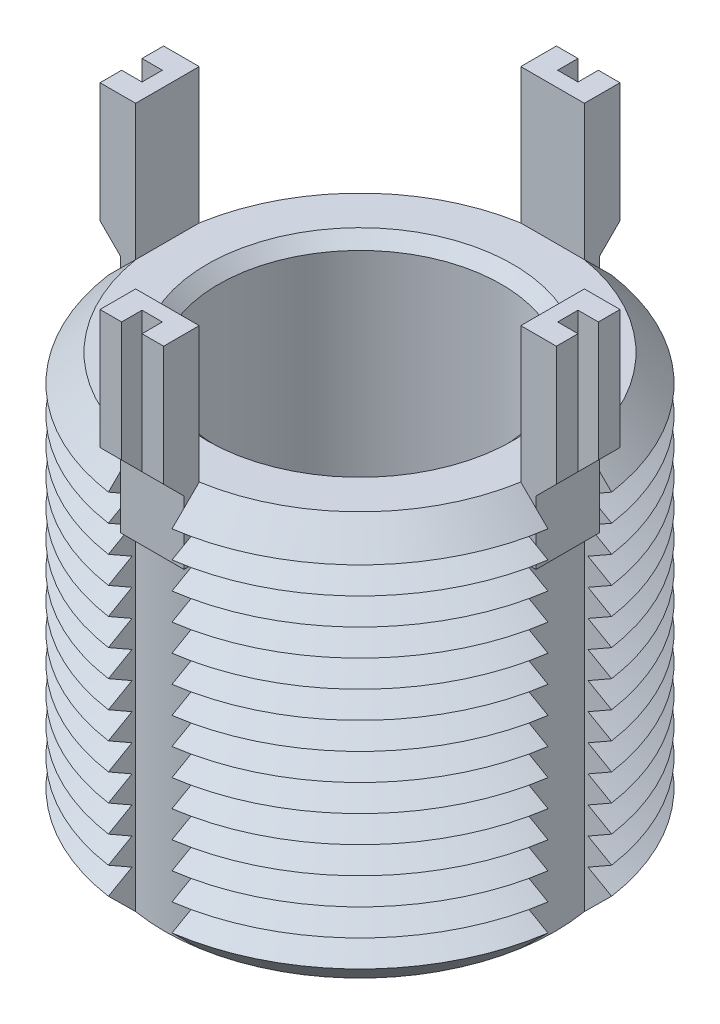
SolidWorks part; units mm, degrees
ref_plane "Front Plane" through (0, 0, 0) normal (0, 0, 1) x (1, 0, 0)
ref_plane "Top Plane" through (0, 0, 0) normal (0, 1, 0) x (1, 0, 0)
ref_plane "Right Plane" through (0, 0, 0) normal (1, 0, 0) x (0, 0, -1)
sketch "Sketch1" plane through (0, 0, 0) normal (0, 1, 0) x (1, 0, 0)
  circle A0 centre (0, 0) radius 17.4625
  dimension "D1" = 34.925
extrude "Boss-Extrude1" add sketch "Sketch1" against normal blind 31.75
chamfer "Chamfer1" distance 2.117 angle 45 2 edges at (0, -31.75, 17.4625) (0, 0, 17.4625)
sketch "Sketch2" plane through (0, 0, 0) normal (1, 0, 0) x (0, 0, -1)
  line L0 (0, 0.8859) -> (0, -9.2617) construction
sketch "Sketch3" plane through (0, 0, 0) normal (1, 0, 0) x (0, 0, -1)
  line L0 (-17.4625, -2.117) -> (-15.6291, -3.1755)
  line L1 (-15.6291, -3.1755) -> (-17.4625, -4.234)
  line L2 (-17.4625, -2.117) -> (-17.4625, -29.633) construction
  line L3 (-17.4625, -4.234) -> (-17.4625, -2.117)
  dimension "D1" = 2.117
revolve "Cut-Revolve1" cut sketch "Sketch3" angle 360 about L0
pattern_linear "LPattern1" count 13 spacing 2.117 along (0, -1, 0) of "Cut-Revolve1"
sketch "Sketch4" plane through (0, 0, 0) normal (0, 1, 0) x (1, 0, 0)
  line L0 (-15.1405, 2.5) -> (-17.2826, 2.5)
  line L2 (-17.2826, -2.5) -> (-15.1405, -2.5)
  arc A0 (-15.1405, 2.5) -> (-15.1405, -2.5) centre (0, 0) ccw
  arc A1 (-17.2826, 2.5) -> (-17.2826, -2.5) centre (0, 0) ccw
  circle A2 centre (0, 0) radius 17.4625 construction
  circle A3 centre (0, 0) radius 15.3455 construction
  point P1 (-15.3455, 0)
  point P3 (-17.4625, 0)
  point P13 (0, 0)
  dimension "D1" = 5
extrude "Cut-Extrude1" cut sketch "Sketch4" against normal up to surface (31.75 mm away)
pattern_circular "CirPattern1" count 4 over 360 about axis through (0, 0, 0) along (0, 1, 0) of "Cut-Extrude1"
sketch "Sketch5" plane through (0, 0, 0) normal (1, 0, 0) x (0, 0, -1)
  line L0 (-15.1405, 10.649) -> (-15.1405, -5.351)
  line L1 (-15.1405, -5.351) -> (-16.3405, -5.351)
  line L2 (-16.3405, -5.351) -> (-16.3405, -0.351)
  line L3 (-16.3405, -0.351) -> (-17.9405, 1.249)
  line L4 (-17.9405, 1.249) -> (-17.9405, 10.649)
  line L5 (-17.9405, 10.649) -> (-15.1405, 10.649)
  line L6 (-17.2826, -6.351) -> (-2.5, -6.351) construction
  point P9 (-2.5, 0)
  point P10 (-16.3405, -0.351)
  dimension "D1" = 1
  dimension "D2" = 16
  dimension "D3" = 11
  dimension "D4" = 2.8
  dimension "D5" = 1.2
  dimension "D6" = 45
extrude "Boss-Extrude3" add sketch "Sketch5" along normal mid plane 5
pattern_circular "CirPattern2" count 4 over 360 about axis through (0, 0, 0) along (0, 1, 0) of "Boss-Extrude3"
sketch "Sketch6" plane through (0, 10.649, 0) normal (0, 1, 0) x (1, 0, 0)
  line L0 (-17.9405, -2.5) -> (-17.9405, 2.5) construction
  line L1 (-17.9405, -0.8) -> (-16.3405, -0.8)
  line L2 (-17.9405, -0.8) -> (-17.9405, 0.8)
  line L3 (-17.9405, 0.8) -> (-16.3405, 0.8)
  line L4 (-16.3405, -0.8) -> (-16.3405, 0.8)
  line L5 (-17.9405, -0.8) -> (-16.3405, 0.8) construction
  line L6 (-17.9405, 0.8) -> (-16.3405, -0.8) construction
  line L7 (17.9405, 2.5) -> (17.9405, -2.5) construction
  line L8 (-0.8, 16.3405) -> (0.8, 16.3405)
  line L9 (-0.8, 16.3405) -> (-0.8, 17.9405)
  line L10 (-0.8, 17.9405) -> (0.8, 17.9405)
  line L11 (0.8, 16.3405) -> (0.8, 17.9405)
  line L12 (-0.8, 16.3405) -> (0.8, 17.9405) construction
  line L13 (-0.8, 17.9405) -> (0.8, 16.3405) construction
  line L14 (16.3405, -0.8) -> (17.9405, -0.8)
  line L15 (16.3405, -0.8) -> (16.3405, 0.8)
  line L16 (16.3405, 0.8) -> (17.9405, 0.8)
  line L17 (17.9405, -0.8) -> (17.9405, 0.8)
  line L18 (16.3405, -0.8) -> (17.9405, 0.8) construction
  line L19 (16.3405, 0.8) -> (17.9405, -0.8) construction
  line L20 (-0.8, -17.9405) -> (0.8, -17.9405)
  line L21 (-0.8, -17.9405) -> (-0.8, -16.3405)
  line L22 (-0.8, -16.3405) -> (0.8, -16.3405)
  line L23 (0.8, -17.9405) -> (0.8, -16.3405)
  line L24 (-0.8, -17.9405) -> (0.8, -16.3405) construction
  line L25 (-0.8, -16.3405) -> (0.8, -17.9405) construction
  line L26 (-2.5, 17.9405) -> (2.5, 17.9405) construction
  line L27 (2.5, -17.9405) -> (-2.5, -17.9405) construction
  point P0 (-17.1405, 0)
  point P7 (-17.9405, 0)
  point P8 (-17.9405, 0)
  point P9 (0, 17.1405)
  point P14 (17.1405, 0)
  point P19 (0, -17.1405)
  point P24 (0, 17.9405)
  point P25 (17.9405, 0)
  point P26 (17.9405, 0)
  point P27 (0, 17.9405)
  point P30 (0, -17.9405)
  point P33 (0, -17.9405)
  dimension "D1" = 1.6
  dimension "D2" = 1.6
extrude "Cut-Extrude3" cut sketch "Sketch6" against normal through all both and the other way through all
sketch "Sketch7" plane through (0, 0, 0) normal (0, 1, 0) x (1, 0, 0)
  circle A0 centre (0, 0) radius 11.1125
  dimension "D1" = 22.225
extrude "Cut-Extrude4" cut sketch "Sketch7" against normal up to surface (31.75 mm away)
chamfer "Chamfer2" distance 0.907 angle 45 2 edges at (0, 0, 11.1125) (0, -31.75, 11.1125)
